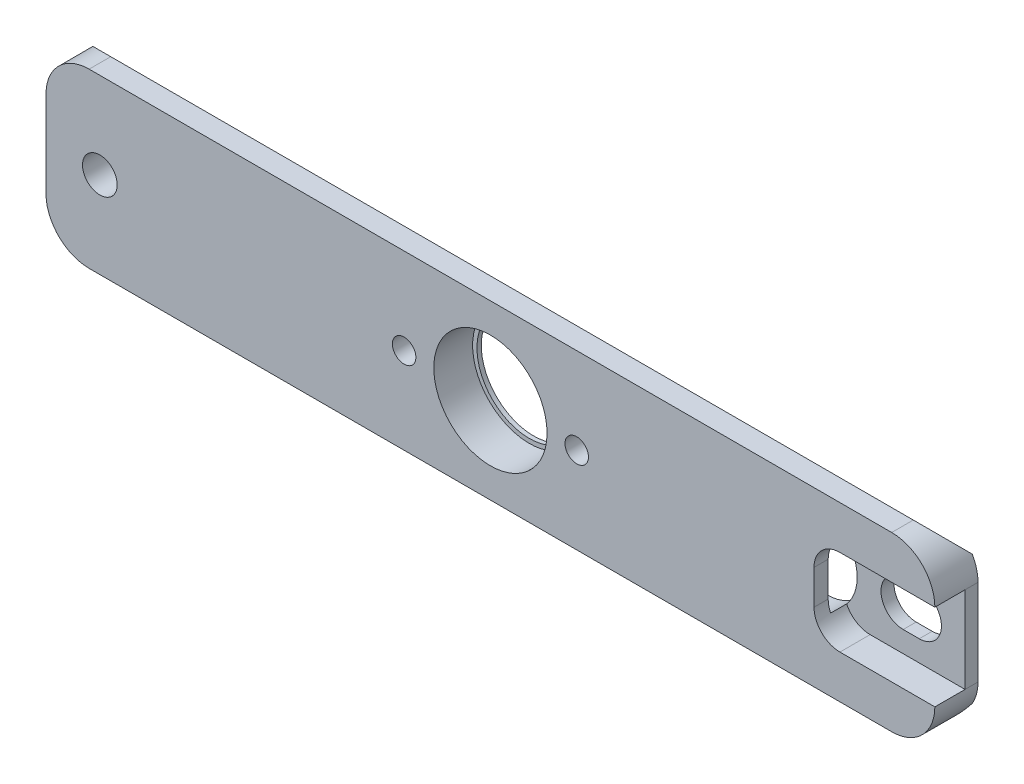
SolidWorks part; units mm, degrees
ref_plane "Front Plane" through (0, 0, 0) normal (0, 0, 1) x (1, 0, 0)
ref_plane "Top Plane" through (0, 0, 0) normal (0, 1, 0) x (1, 0, 0)
ref_plane "Right Plane" through (0, 0, 0) normal (1, 0, 0) x (0, 0, -1)
sketch "Sketch1" plane through (0, 0, 0) normal (0, 0, 1) x (1, 0, 0)
  line L0 (0, 0) -> (-78.5452, 0) construction
  line L1 (-65.405, 12.7) -> (65.405, 12.7)
  line L2 (-65.405, 12.7) -> (-65.405, -12.7)
  line L3 (-65.405, -12.7) -> (65.405, -12.7)
  line L4 (65.405, 12.7) -> (65.405, -12.7)
  line L5 (-65.405, 12.7) -> (65.405, -12.7) construction
  line L6 (-65.405, -12.7) -> (65.405, 12.7) construction
  point P0 (0, 0)
  dimension "D1" = 25.4
  dimension "D2" = 130.81
extrude "Boss-Extrude1" add sketch "Sketch1" along normal blind 6.35
hole_wizard "1/4-20 Tapped Hole1" positions "Sketch5" profile "Sketch6" tap size "1/4-20" standard "ANSI Inch"
sketch "Sketch5" plane through (0, 0, 6.35) normal (0, 0, 1) x (1, 0, 0)
  line L0 (-57.4802, 12.7) -> (-57.4802, -12.7) construction
  line L1 (65.405, 12.7) -> (-65.405, 12.7) construction
  line L2 (-65.405, -12.7) -> (65.405, -12.7) construction
  line L4 (-66.675, 0) -> (0, 0) construction
  line L7 (0, 12.7) -> (0, -12.7) construction
  point P0 (-57.4802, 0)
  dimension "D1" = 57.4802
sketch "Sketch6" plane through (-57.4802, 0, 6.35) normal (1, 0, 0) x (0, -1, 0)
  line L0 (0, 0) -> (0, 6.35)
  line L1 (0, 6.35) -> (2.5527, 6.35)
  line L2 (2.5527, 6.35) -> (2.5527, 0)
  line L5 (2.5527, 0) -> (0, 0)
  line L11 (0, -6.35) -> (0, 107.95) construction
  dimension "Thru Tap Drill Dia." = 5.1054
  dimension "Thru Tap Drill Depth" = 6.35
fillet "Fillet1" radius 6.35 4 edges at (-65.405, 12.7, 3.175) (-65.405, -12.7, 3.175) (65.405, -12.7, 3.175) (65.405, 12.7, 3.175)
chamfer "Chamfer1" distance 3.175 angle 45 2 edges at (0, -12.7, 0) (0, 12.7, 0)
hole_wizard "1/4 Clearance Slot1" positions "Sketch9" profile "Sketch10" size "1/4" standard "ANSI Inch"
sketch "Sketch9" plane through (0, 0, 0) normal (0, 0, -1) x (-1, 0, 0)
  line L0 (0, 0) -> (-66.675, 0) construction
  line L5 (-53.0352, 0) -> (-61.9252, 0) construction
  point P0 (-57.4802, 0)
  dimension "D1" = 57.4802
  dimension "D2" = 8.89
sketch "Sketch10" plane through (57.4802, 0, 0) normal (1, 0, 0) x (0, 1, 0)
  line L0 (0, 0) -> (0, 6.35)
  line L1 (0, 6.35) -> (3.2639, 6.35)
  line L2 (3.2639, 6.35) -> (3.2639, 0)
  line L5 (3.2639, 0) -> (0, 0)
  line L11 (0, -6.35) -> (0, 107.95) construction
  dimension "Thru Hole Dia." = 6.5278
  dimension "Thru Hole Depth" = 6.35
sketch "Sketch11" plane through (0, 0, 6.35) normal (0, 0, 1) x (1, 0, 0)
  line L0 (0, 0) -> (66.675, 0) construction
  line L1 (51.435, 6.35) -> (71.12, 6.35)
  line L2 (47.625, 2.54) -> (47.625, -2.54)
  line L3 (51.435, -6.35) -> (71.12, -6.35)
  line L4 (71.12, 6.35) -> (71.12, -6.35)
  arc A0 (47.625, -2.54) -> (51.435, -6.35) centre (51.435, -2.54) ccw
  arc A1 (51.435, 6.35) -> (47.625, 2.54) centre (51.435, 2.54) ccw
  dimension "D5" = 3.81
  dimension "D1" = 47.625
  dimension "D2" = 71.12
  dimension "D3" = 6.35
  dimension "D4" = 6.35
extrude "Cut-Extrude2" cut sketch "Sketch11" against normal blind 4.445
hole_wizard "#8-32 Tapped Hole1" positions "Sketch12" profile "Sketch13" tap size "#8-32" standard "ANSI Inch"
sketch "Sketch12" plane through (0, 0, 0) normal (0, 0, -1) x (-1, 0, 0)
  point P0 (-12.7, 0)
  point P3 (12.7, 0)
sketch "Sketch13" plane through (12.7, 0, 0) normal (1, 0, 0) x (0, 1, 0)
  line L0 (0, 0) -> (0, 6.35)
  line L1 (0, 6.35) -> (1.7272, 6.35)
  line L2 (1.7272, 6.35) -> (1.7272, 0)
  line L5 (1.7272, 0) -> (0, 0)
  line L11 (0, -6.35) -> (0, 107.95) construction
  dimension "Thru Tap Drill Dia." = 3.4544
  dimension "Thru Tap Drill Depth" = 6.35
sketch "Sketch15" plane through (0, 0, 6.35) normal (0, 0, 1) x (1, 0, 0)
  circle A0 centre (0, 0) radius 8.3344
extrude "Cut-Extrude4" cut sketch "Sketch15" against normal blind 5.715
sketch "Sketch16" plane through (0, 0, 0.635) normal (0, 0, 1) x (1, 0, 0)
  circle A0 centre (0, 0) radius 7.6994
extrude "Cut-Extrude5" cut sketch "Sketch16" against normal blind 5.715
sketch "Sketch17" plane through (0, 0, 0) normal (0, 0, -1) x (-1, 0, 0)
  line L0 (0, 0) -> (0, -30.6043) construction
  line L1 (0, 0) -> (77.5654, 0) construction
  circle A0 centre (43.18, 0) radius 6.35
  circle A1 centre (57.4802, 0) radius 6.35 construction
  circle A2 centre (-43.18, 0) radius 6.35
  dimension "D1" = 43.18
  dimension "D2" = 12.7
extrude "Cut-Extrude6" cut sketch "Sketch17" against normal blind 2.54
sketch "Sketch18" plane through (0, 0, 0) normal (0, 0, -1) x (-1, 0, 0)
  circle A1 centre (-43.18, 0) radius 6.35
  circle A2 centre (-43.18, 0) radius 6.35
  circle A3 centre (43.18, 0) radius 6.35
  circle A4 centre (43.18, 0) radius 6.35
  dimension "D1" = 0
  dimension "D2" = 0
extrude "Cut-Extrude7" cut sketch "Sketch18" against normal blind 4.2672
